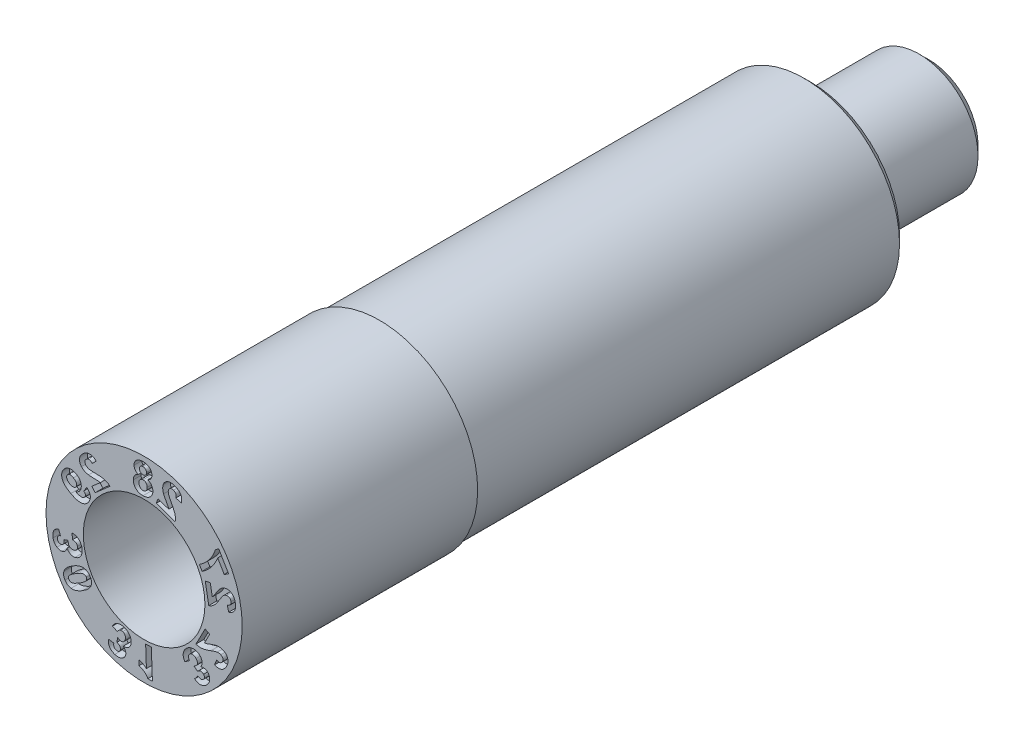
SolidWorks part; units mm, degrees
other "<M3 X .5 SHSS>-<Revolve1>"
ref_plane "Front Plane" through (0, 0, 0) normal (0, 0, 1) x (1, 0, 0)
ref_plane "Top Plane" through (0, 0, 0) normal (0, 1, 0) x (1, 0, 0)
ref_plane "Right Plane" through (0, 0, 0) normal (1, 0, 0) x (0, 0, -1)
sketch "Sketch1" plane through (0, 0, 0) normal (1, 0, 0) x (0, 0, -1)
  line L2 (0, 2.5) -> (0, 1.55)
  line L3 (16.75, 2.5) -> (0, 2.5)
  line L4 (-3.7979, 0) -> (49996.2021, 0) construction
  line L8 (14, 0.8) -> (2.8, 0.8)
  line L9 (2.8, 1.55) -> (2.8, 0.8)
  line L10 (2.8, 1.55) -> (0, 1.55)
  line L12 (17, 1.5) -> (17, 2.25)
  line L16 (17, 2.25) -> (16.75, 2.5)
  line L17 (17, 1.5) -> (14, 1.5)
  line L18 (14, 0.8) -> (14, 1.5)
  dimension "D1" = 17
  dimension "D2" = 45
  dimension "D3" = 0.25
  dimension "D4" = 5
  dimension "D5" = 3.1
  dimension "D6" = 2.8
  dimension "D7" = 1.6
  dimension "D8" = 3
  dimension "D9" = 3
revolve "Revolve1" add sketch "Sketch1" angle 360 about L4
sketch "Sketch4" plane through (0, 0, 0) normal (1, 0, 0) x (0, 0, -1)
  line L0 (0, 0) -> (50000, 0) construction
  line L1 (17, -2.25) -> (17, 2.25) construction
  line L2 (6, 3.435) -> (17, 3.435)
  line L3 (6, 3.435) -> (6, 2.435)
  line L4 (6, 2.435) -> (17, 2.435)
  line L5 (17, 3.435) -> (17, 2.435)
  line L6 (16.75, 2.5) -> (0, 2.5) construction
  line L7 (0, 2.5) -> (0, -2.5) construction
  dimension "D1" = 1
  dimension "D2" = 0.065
  dimension "D3" = 6
revolve "Cut-Revolve1" cut sketch "Sketch4" angle 360 about L0
sketch "Sketch2" plane through (0, 0, 0) normal (0, 0, 1) x (1, 0, 0)
  line L0 (0, 0) -> (0, 3.063) construction
  line L1 (0, 0) -> (2.6527, 1.5315) construction
  line L2 (0, 0) -> (2.6527, -1.5315) construction
  line L3 (0, 0) -> (0, -3.063) construction
  line L4 (0, 0) -> (-2.6527, -1.5315) construction
  line L5 (0, 0) -> (-2.6527, 1.5315) construction
  circle A0 centre (0, 0) radius 1.6531 construction
  text T0 "27  28  29  30  31  32" font "Arial" height 0.743
  point P10 (0, 0)
  point P405 (0, 0.0042)
  point P406 (0.0042, 0.0042)
  point P407 (0.0042, 0)
  dimension "D2" = 6
extrude "Cut-Extrude1" cut sketch "Sketch2" against normal blind 0.2
sketch "Sketch3" plane through (0, 0, -2.8) normal (0, 0, 1) x (1, 0, 0)
  line L0 (0, 0) -> (0, 50000) construction
  line L1 (0.4619, 0.8) -> (-0.4619, 0.8)
  line L2 (-0.4619, 0.8) -> (-0.9238, 0)
  line L3 (-0.9238, 0) -> (-0.4619, -0.8)
  line L4 (-0.4619, -0.8) -> (0.4619, -0.8)
  line L5 (0.4619, -0.8) -> (0.9238, 0)
  line L6 (0.9238, 0) -> (0.4619, 0.8)
  line L7 (0, 0) -> (50000, 0) construction
  circle A0 centre (0, 0) radius 0.8 construction
  circle A1 centre (0, 0) radius 0.8 construction
extrude "Cut-Extrude2" cut sketch "Sketch3" against normal blind 1.4
inserted part "M3 X .5 SHSS"
move or copy body "Body-Move/Copy2" placed by mates yes
